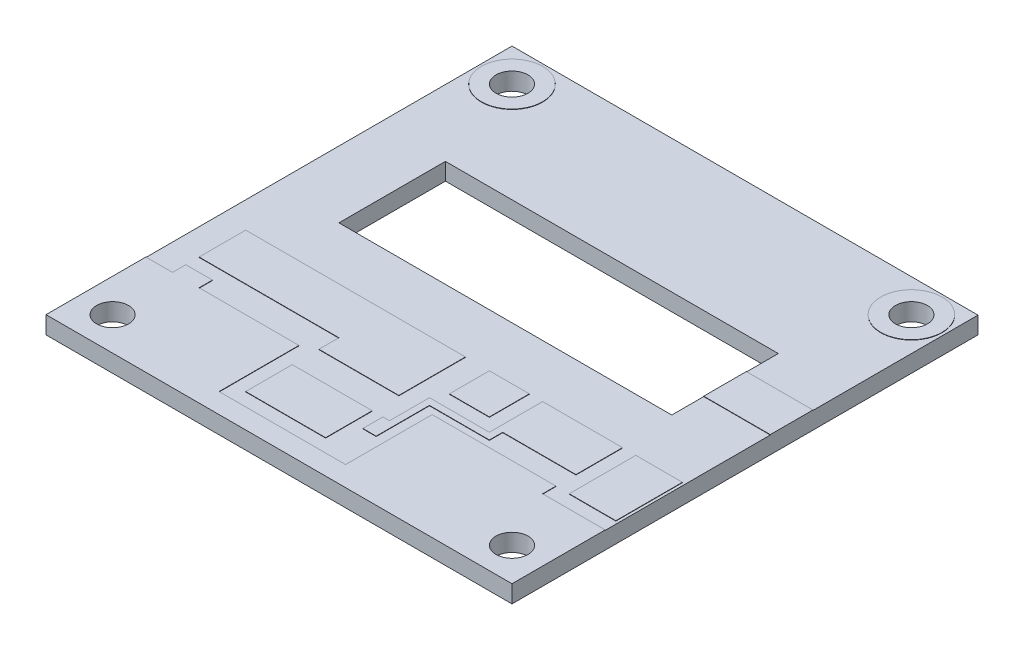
SolidWorks part; units mm, degrees
ref_plane "Front Plane" through (0, 0, 0) normal (0, 0, 1) x (1, 0, 0)
ref_plane "Top Plane" through (0, 0, 0) normal (0, 1, 0) x (1, 0, 0)
ref_plane "Right Plane" through (0, 0, 0) normal (1, 0, 0) x (0, 0, -1)
sketch "Sketch1" plane through (0, 0, 0) normal (0, 1, 0) x (1, 0, 0)
  line L1 (-22.225, -22.225) -> (22.225, -22.225)
  line L2 (-22.225, -22.225) -> (-22.225, 22.225)
  line L3 (-22.225, 22.225) -> (22.225, 22.225)
  line L4 (22.225, -22.225) -> (22.225, 22.225)
  line L5 (-22.225, -22.225) -> (22.225, 22.225) construction
  line L6 (-22.225, 22.225) -> (22.225, -22.225) construction
  point P0 (0, 0)
extrude "Boss-Extrude1" add sketch "Sketch1" along normal blind 1.6002
sketch "Sketch7" plane through (0, 0, 0) normal (0, -1, 0) x (1, 0, 0)
  line L1 (-22.225, -22.225) -> (22.225, -22.225)
  line L2 (-22.225, -22.225) -> (-22.225, 22.225)
  line L3 (-22.225, 22.225) -> (22.225, 22.225)
  line L4 (22.225, -22.225) -> (22.225, 22.225)
  line L5 (-22.225, -22.225) -> (22.225, 22.225) construction
  line L6 (-22.225, 22.225) -> (22.225, -22.225) construction
  point P0 (0, 0)
extrude "Boss-Extrude3" add sketch "Sketch7" along normal blind 0.0356
sketch "Sketch3" plane through (0, 1.6002, 0) normal (0, 1, 0) x (1, 0, 0)
  line L0 (-22.225, 22.225) -> (-22.225, 9.525) construction
  line L1 (-22.225, 22.225) -> (-22.225, -22.225) construction
  line L2 (-22.225, 9.525) -> (-15.875, 9.525) construction
  line L3 (22.225, 9.525) -> (15.875, 9.525) construction
  line L4 (22.225, -22.225) -> (22.225, 22.225) construction
  line L9 (15.875, 9.525) -> (-15.875, 9.525)
  line L10 (-15.875, 9.525) -> (-15.875, -0.635)
  line L11 (-15.875, -0.635) -> (15.875, -0.635)
  line L12 (15.875, -0.635) -> (15.875, 9.525)
extrude "Cut-Extrude2" cut sketch "Sketch3" against normal through all
sketch "Sketch10" plane through (0, 1.6002, 0) normal (0, 1, 0) x (1, 0, 0)
  line L9 (1.27, -14.605) -> (-6.35, -14.605)
  line L10 (-6.35, -14.605) -> (-6.35, -19.05)
  line L11 (-6.35, -19.05) -> (1.27, -19.05)
  line L12 (1.27, -19.05) -> (1.27, -14.605)
  line L17 (-22.225, -22.225) -> (-22.225, -12.7)
  line L18 (-22.225, 22.225) -> (-22.225, -22.225) construction
  line L19 (-22.225, -12.7) -> (-19.685, -12.7)
  line L20 (-19.685, -12.7) -> (-19.685, -11.43)
  line L21 (-19.685, -11.43) -> (-17.145, -11.43)
  line L22 (-17.145, -11.43) -> (-17.145, -12.7)
  line L32 (22.225, -22.225) -> (22.225, 22.225) construction
  line L34 (22.225, -22.225) -> (-22.225, -22.225)
  line L35 (15.875, 4.445) -> (15.875, 6.477)
  line L36 (15.875, -0.635) -> (15.875, 9.525) construction
  line L37 (15.875, 6.477) -> (22.225, 6.477)
  line L38 (22.225, 6.477) -> (22.225, 2.413)
  line L39 (22.225, 2.413) -> (15.875, 2.413)
  line L40 (15.875, 2.413) -> (15.875, 4.445)
  line L58 (21.971, -5.715) -> (17.526, -5.715)
  line L59 (17.526, -5.715) -> (17.526, -12.065)
  line L60 (17.526, -12.065) -> (21.971, -12.065)
  line L73 (21.971, -12.065) -> (21.971, -5.715)
  line L75 (22.225, -13.335) -> (22.225, -22.225)
  line L77 (16.256, -13.335) -> (22.225, -13.335)
  line L80 (3.556, -5.715) -> (3.556, -9.525)
  line L81 (16.256, -10.16) -> (16.256, -5.715)
  line L82 (-19.685, -10.16) -> (-19.685, -5.715)
  line L83 (-19.685, -5.715) -> (1.27, -5.715)
  line L94 (3.556, -5.715) -> (7.366, -5.715)
  line L95 (7.366, -5.715) -> (7.366, -9.525)
  line L96 (7.366, -9.525) -> (3.556, -9.525)
  line L97 (16.256, -5.715) -> (8.636, -5.715)
  line L98 (8.636, -5.715) -> (8.636, -10.16)
  line L99 (9.271, -10.16) -> (16.256, -10.16)
  line L100 (-17.145, -12.7) -> (-7.62, -12.7)
  line L101 (-7.62, -12.7) -> (-7.62, -20.32)
  line L103 (-6.35, -12.065) -> (-6.35, -10.16)
  line L104 (-6.35, -10.16) -> (-19.685, -10.16)
  line L105 (-6.35, -12.065) -> (1.27, -12.065)
  line L106 (1.27, -12.065) -> (1.27, -5.715)
  line L107 (-7.62, -20.32) -> (4.445, -20.32)
  line L108 (4.445, -20.32) -> (4.445, -12.065)
  line L109 (4.445, -12.065) -> (16.256, -12.065)
  line L110 (16.256, -12.065) -> (16.256, -13.335)
  line L111 (8.636, -10.16) -> (8.636, -10.795)
  line L115 (3.556, -12.065) -> (3.556, -11.43)
  line L116 (3.556, -11.43) -> (9.271, -11.43)
  line L117 (9.271, -11.43) -> (9.271, -10.16)
  line L118 (8.636, -10.795) -> (2.921, -10.795)
  line L123 (3.556, -16.51) -> (3.556, -12.065)
  line L124 (2.921, -10.795) -> (2.921, -14.605)
  line L125 (2.921, -14.605) -> (2.286, -14.605)
  line L126 (2.286, -14.605) -> (2.286, -16.51)
  line L127 (2.286, -16.51) -> (3.556, -16.51)
extrude "Boss-Extrude5" add sketch "Sketch10" along normal blind 0.0356
sketch "Sketch34" plane through (0, 1.6002, 0) normal (0, 1, 0) x (1, 0, 0)
  circle A0 centre (-19.05, 19.05) radius 2.921
  circle A1 centre (19.05, 19.05) radius 2.921
extrude "Boss-Extrude6" add sketch "Sketch34" along normal blind 0.0356
sketch "Sketch35" plane through (0, 1.6358, 0) normal (0, 1, 0) x (1, 0, 0)
  circle A0 centre (-19.05, 19.05) radius 1.524
  circle A1 centre (19.05, 19.05) radius 1.524
  circle A2 centre (19.05, -19.05) radius 1.524
  circle A4 centre (-19.05, -19.05) radius 1.524
extrude "Cut-Extrude3" cut sketch "Sketch35" against normal through all
